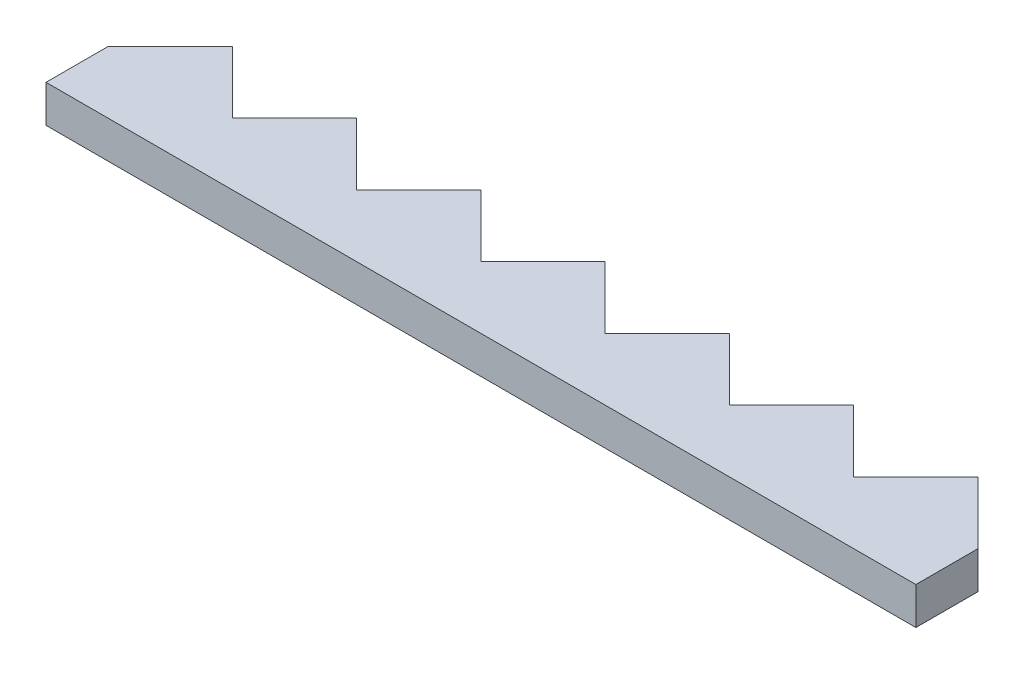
SolidWorks part; units mm, degrees
ref_plane "Front Plane" through (0, 0, 0) normal (0, 0, 1) x (1, 0, 0)
ref_plane "Top Plane" through (0, 0, 0) normal (0, 1, 0) x (1, 0, 0)
ref_plane "Right Plane" through (0, 0, 0) normal (1, 0, 0) x (0, 0, -1)
sketch "Sketch1" plane through (0, 0, 0) normal (0, 1, 0) x (1, 0, 0)
  line L0 (0, 5) -> (5, 10)
  line L2 (0, 5) -> (0, 0)
  line L3 (0, 0) -> (70, 0)
  line L5 (5, 10) -> (10, 5)
  line L6 (10, 5) -> (15, 10)
  line L7 (15, 10) -> (20, 5)
  line L8 (20, 5) -> (25, 10)
  line L9 (25, 10) -> (30, 5)
  line L10 (30, 5) -> (35, 10)
  line L11 (35, 10) -> (40, 5)
  line L12 (40, 5) -> (45, 10)
  line L13 (45, 10) -> (50, 5)
  line L14 (50, 5) -> (55, 10)
  line L15 (55, 10) -> (60, 5)
  line L16 (60, 5) -> (65, 10)
  line L17 (65, 10) -> (70, 5)
  line L18 (5, 10) -> (65, 10) construction
  line L19 (70, 5) -> (70, 0)
  point P4 (0, 0)
  dimension "D1" = 5
  dimension "D2" = 10
  dimension "D4" = 10
  dimension "D5" = 7
extrude "Boss-Extrude1" add sketch "Sketch1" along normal blind 3
